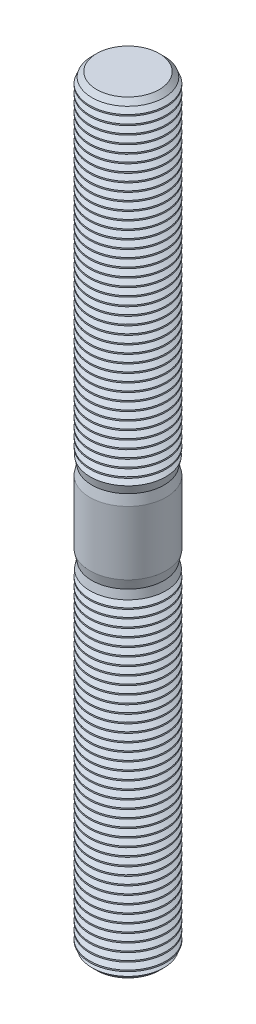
SolidWorks part; units mm, degrees
other "<double end studs (clamping type)_am>-<LPattern11>"
ref_plane "Front Plane" through (0, 0, 0) normal (0, 0, 1) x (1, 0, 0)
ref_plane "Top Plane" through (0, 0, 0) normal (0, 1, 0) x (1, 0, 0)
ref_plane "Right Plane" through (0, 0, 0) normal (1, 0, 0) x (0, 0, -1)
inserted part "double end studs (clamping type)_am"
move or copy body "Body-Move/Copy3" bodies to move or copy 103 copy no rotation origin (178.7378, 224.3621, 0) rotation axis (0, 0, 1) rotation angle 90
